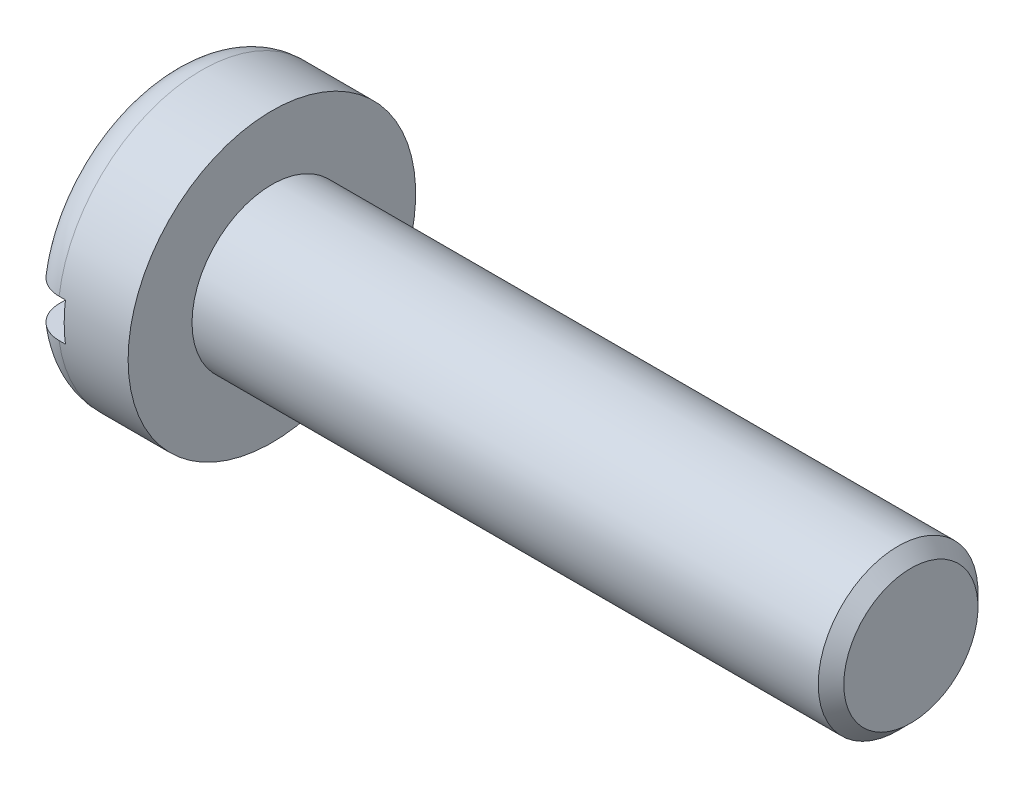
SolidWorks part; units mm, degrees
ref_plane "Face" through (0, 0, 0) normal (0, 0, 1) x (1, 0, 0)
ref_plane "Dessus" through (0, 0, 0) normal (0, 1, 0) x (1, 0, 0)
ref_plane "Droite" through (0, 0, 0) normal (1, 0, 0) x (0, 0, -1)
sketch "Esquisse1" plane through (0, 0, 0) normal (0, 0, 1) x (1, 0, 0)
  line L0 (-28.9827, 0) -> (28.9827, 0) construction
  line L1 (-1.6, 0) -> (-1.6, 2.25)
  line L2 (-1.6, 2.25) -> (0, 2.25)
  line L3 (0, 2.25) -> (0, 1.25)
  line L4 (0, 1.25) -> (10, 1.25)
  line L5 (10, 1.25) -> (10, 0)
  line L6 (10, 0) -> (-1.6, 0)
  dimension "D1" = 1.25
  dimension "D2" = 10
  dimension "D3" = 2.25
  dimension "D4" = 1.6
revolve "Base-Révolution" add sketch "Esquisse1" angle 360 about L0
chamfer "Chanfrein1" distance 0.2 angle 45 1 edges at (10, 0, 1.25)
fillet "Congé1" radius 0.5 1 edges at (-1.6, 0, 2.25)
sketch "Esquisse2" plane through (-1.6, 0, 0) normal (-1, 0, 0) x (0, 0, 1)
  line L0 (0.5774, -1) -> (-0.5774, -1)
  line L1 (-0.5774, -1) -> (-1.1547, 0)
  line L2 (-1.1547, 0) -> (-0.5774, 1)
  line L3 (-0.5774, 1) -> (0.5774, 1)
  line L4 (0.5774, 1) -> (1.1547, 0)
  line L5 (1.1547, 0) -> (0.5774, -1)
  circle A0 centre (0, 0) radius 1 construction
  dimension "D1" = 2
  dimension "D2" = 120
  dimension "D3" = 120
  dimension "D4" = 120
  dimension "D5" = 120
extrude "Empreinte pour clé" [suppressed] cut sketch "Esquisse2" against normal blind 2.5
sketch "Esquisse3" plane through (0, 0, 0) normal (0, 0, 1) x (1, 0, 0)
  line L0 (-1.7679, 0.3) -> (-1, 0.3)
  line L1 (-1, 0.3) -> (-1, -0.3)
  line L2 (-1, -0.3) -> (-1.7679, -0.3)
  line L3 (-1.7679, -0.3) -> (-1.7679, 0.3)
  line L4 (0, 0) -> (6.9797, 0) construction
  line L5 (-28.9827, 0) -> (28.9827, 0) construction
  line L7 (-1.6, 1.75) -> (-1.6, -1.75) construction
  line L8 (-1.6, 1.75) -> (-1.6, -1.75) construction
  dimension "D1" = 0.6
  dimension "D2" = 0.6
extrude "Enlèv. mat.-Extru.1" cut sketch "Esquisse3" against normal mid plane 10
sketch "Esq_WRNL_Compact001" plane through (0, 0, 0) normal (0, 0, 1) x (1, 0, 0)
  line L0 (-2.6294, -3.25) -> (-2.6294, 3.25)
  line L1 (11, -3.25) -> (11, 3.25)
  line L2 (-2.6294, -3.25) -> (11, -3.25)
  line L3 (-2.6294, 3.25) -> (11, 3.25)
